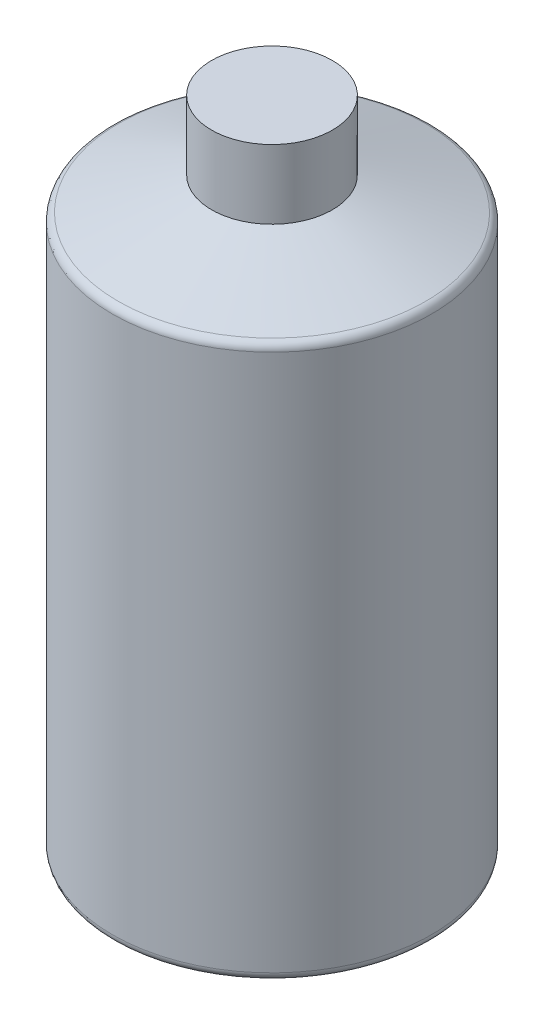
SolidWorks part; units mm, degrees
ref_plane "Front Plane" through (0, 0, 0) normal (0, 0, 1) x (1, 0, 0)
ref_plane "Top Plane" through (0, 0, 0) normal (0, 1, 0) x (1, 0, 0)
ref_plane "Right Plane" through (0, 0, 0) normal (1, 0, 0) x (0, 0, -1)
sketch "Sketch1" plane through (0, 0, 0) normal (0, 0, 1) x (1, 0, 0)
  line L0 (0, 0) -> (0, 295.5982) construction
  line L1 (0, 241.3) -> (-22.225, 241.3)
  line L2 (-22.225, 241.3) -> (-22.225, 215.9)
  line L3 (-22.225, 215.9) -> (-58.7375, 203.2)
  line L4 (-58.7375, 203.2) -> (-58.7375, 0)
  line L5 (-58.7375, 0) -> (0, 0)
  line L6 (0, 0) -> (0, 241.3)
  dimension "D1" = 117.475
  dimension "D2" = 241.3
  dimension "D3" = 203.2
  dimension "D4" = 25.4
  dimension "D5" = 44.45
revolve "Revolve1" add sketch "Sketch1" angle 360 about L0
fillet "Fillet1" radius 3.175 2 edges at (0, 0, -58.7375) (0, 203.2, -58.7375)
